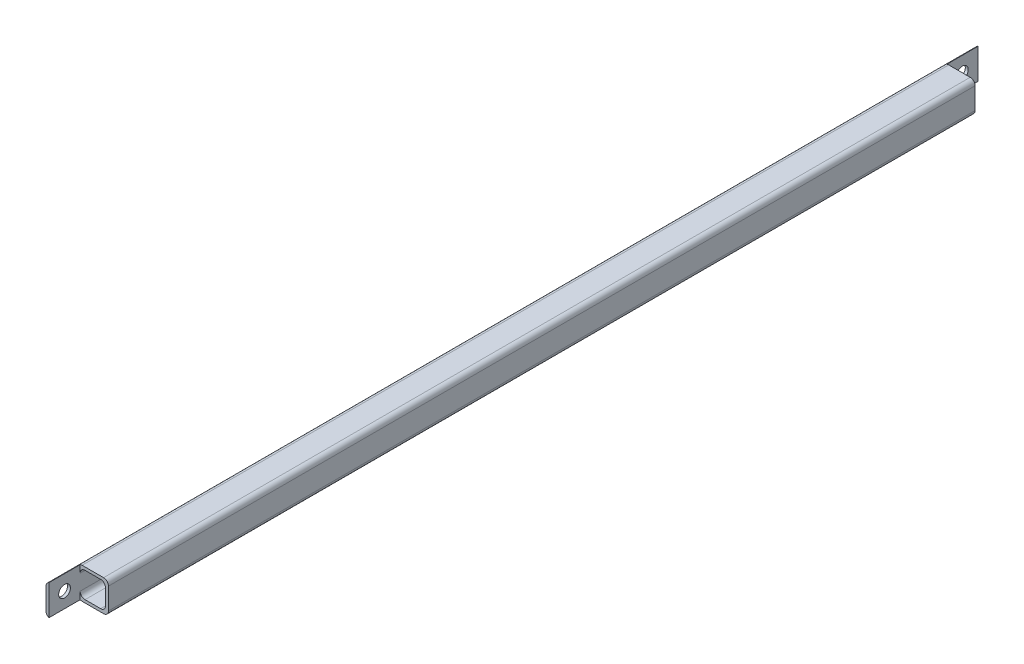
SolidWorks part; units mm, degrees
ref_plane "Plan1" through (0, 0, 0) normal (0, 0, 1) x (1, 0, 0)
ref_plane "Plan2" through (0, 0, 0) normal (0, 1, 0) x (1, 0, 0)
ref_plane "Plan3" through (0, 0, 0) normal (1, 0, 0) x (0, 0, -1)
sketch "Esquisse1" plane through (0, 0, 0) normal (0, 0, 1) x (1, 0, 0)
  line L0 (-5.5, 8) -> (5.5, 8)
  line L1 (-8, 5.5) -> (-8, -5.5)
  line L2 (5.5, -8) -> (-5.5, -8)
  line L3 (8, -5.5) -> (8, 5.5)
  line L4 (-4, 6.5) -> (4, 6.5)
  line L5 (-6.5, 4) -> (-6.5, -4)
  line L6 (4, -6.5) -> (-4, -6.5)
  line L7 (6.5, -4) -> (6.5, 4)
  line L8 (-48.7418, 0) -> (48.7418, 0) construction
  line L9 (0, 57.3432) -> (0, -57.3432) construction
  arc A0 (-4, 6.5) -> (-6.5, 4) centre (-4, 4) ccw
  arc A1 (6.5, 4) -> (4, 6.5) centre (4, 4) ccw
  arc A2 (6.5, -4) -> (4, -6.5) centre (4, -4) cw
  arc A3 (-6.5, -4) -> (-4, -6.5) centre (-4, -4) ccw
  arc A4 (-5.5, 8) -> (-8, 5.5) centre (-5.5, 5.5) ccw
  arc A5 (8, 5.5) -> (5.5, 8) centre (5.5, 5.5) ccw
  arc A6 (8, -5.5) -> (5.5, -8) centre (5.5, -5.5) cw
  arc A7 (-5.5, -8) -> (-8, -5.5) centre (-5.5, -5.5) cw
  dimension "D1" = 2.5
  dimension "D2" = 16
  dimension "D3" = 13
  dimension "D4" = 13
  dimension "D5" = 16
extrude "Base-Extrusion" add sketch "Esquisse1" along normal mid plane 476
sketch "Esquisse2" plane through (0, 0, 0) normal (0, 1, 0) x (1, 0, 0)
  line L0 (-6.5, 238) -> (8, 238)
  line L1 (-6.5, 238) -> (-6.5, 222)
  line L2 (8, 222) -> (-6.5, 222)
  line L3 (8, 222) -> (8, 238)
  line L4 (-6.5, -238) -> (-6.5, 238) construction
  line L5 (8, -238) -> (8, 238) construction
  line L6 (-5.5, 238) -> (5.5, 238) construction
  line L7 (-36.8756, 0) -> (36.8756, 0) construction
  line L8 (8, -222) -> (8, -238)
  line L9 (8, -222) -> (-6.5, -222)
  line L10 (-6.5, -238) -> (-6.5, -222)
  line L11 (-6.5, -238) -> (8, -238)
  dimension "D1" = 16
extrude "Enlèv. mat.-Extru.1" cut sketch "Esquisse2" against normal through all and the other way through all
sketch "Esquisse3" plane through (0, 0, 0) normal (1, 0, 0) x (0, 0, -1)
  line L0 (0, 45.2403) -> (0, -44.235) construction
  circle A0 centre (230, 0) radius 3
  circle A1 centre (-230, 0) radius 3
  dimension "D1" = 6
  dimension "D2" = 460
extrude "Enlèv. mat.-Extru.2" cut sketch "Esquisse3" against normal through all
